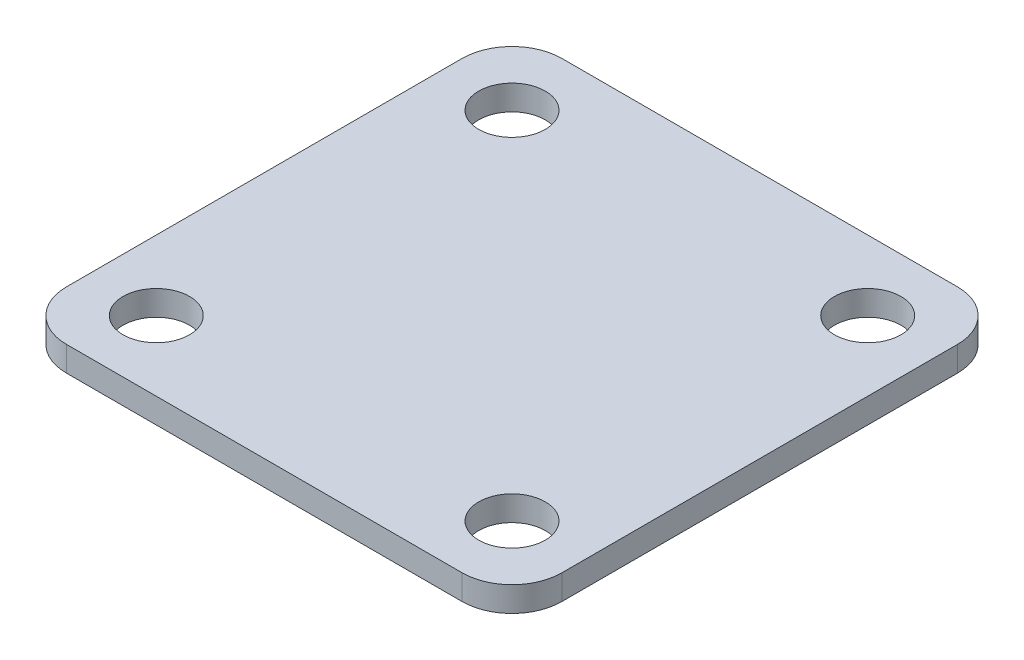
SolidWorks part; units mm, degrees
ref_plane "Front Plane" through (0, 0, 0) normal (0, 0, 1) x (1, 0, 0)
ref_plane "Top Plane" through (0, 0, 0) normal (0, 1, 0) x (1, 0, 0)
ref_plane "Right Plane" through (0, 0, 0) normal (1, 0, 0) x (0, 0, -1)
sketch "Sketch1" plane through (0, 0, 0) normal (0, 1, 0) x (1, 0, 0)
  circle A0 centre (0, 0) radius 3.4925
  dimension "D1" = 6.985
extrude "Boss-Extrude1" add sketch "Sketch1" along normal blind 1.778
sketch "Sketch2" plane through (0, 1.778, 0) normal (0, 1, 0) x (1, 0, 0)
  circle A0 centre (0, 0) radius 5.969
  dimension "D1" = 11.938
extrude "Boss-Extrude2" add sketch "Sketch2" along normal blind 4.699
sketch "Sketch3" plane through (0, 6.477, 0) normal (0, 1, 0) x (1, 0, 0)
  line L1 (-15.113, 18.923) -> (15.113, 18.923)
  line L2 (-18.923, 15.113) -> (-18.923, -15.113)
  line L3 (-15.113, -18.923) -> (15.113, -18.923)
  line L4 (18.923, 15.113) -> (18.923, -15.113)
  arc A0 (-18.923, -15.113) -> (-15.113, -18.923) centre (-15.113, -15.113) ccw
  arc A1 (15.113, -18.923) -> (18.923, -15.113) centre (15.113, -15.113) ccw
  arc A2 (15.113, 18.923) -> (18.923, 15.113) centre (15.113, 15.113) cw
  arc A3 (-15.113, 18.923) -> (-18.923, 15.113) centre (-15.113, 15.113) ccw
  circle A4 centre (-13.589, 13.589) radius 2.54
  circle A5 centre (13.589, 13.589) radius 2.54
  circle A6 centre (13.589, -13.589) radius 2.54
  circle A7 centre (-13.589, -13.589) radius 2.54
  point P7 (-18.923, -18.923)
  point P12 (18.923, 18.923)
  point P15 (-18.923, 18.923)
  point P27 (0, 0)
  dimension "D5" = 3.81
  dimension "D6" = 5.08
  dimension "D1" = 37.846
  dimension "D2" = 37.846
  dimension "D3" = 18.923
  dimension "D4" = 18.923
  dimension "D7" = 5.334
  dimension "D8" = 5.334
  dimension "D9" = 4
extrude "Boss-Extrude3" add sketch "Sketch3" along normal blind 1.905
chamfer "Chamfer1" distance 1.4224 angle 69 1 edges at (0, 6.477, 5.969)
fillet "Fillet1" radius 1.27 1 edges at (0, 1.778, 5.969)
